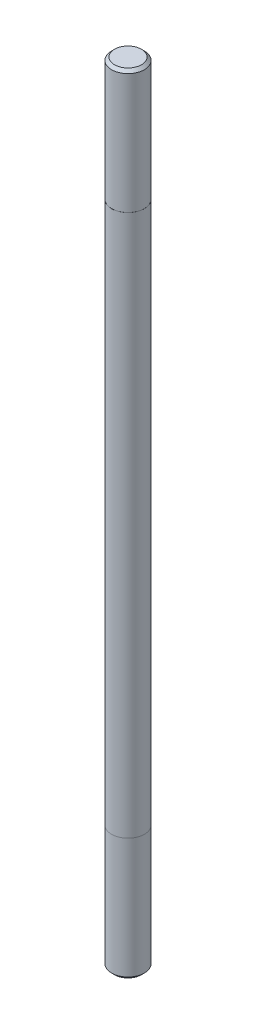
SolidWorks part; units mm, degrees
ref_plane "Front" through (0, 0, 0) normal (0, 0, 1) x (1, 0, 0)
ref_plane "Top" through (0, 0, 0) normal (0, 1, 0) x (1, 0, 0)
ref_plane "Right" through (0, 0, 0) normal (1, 0, 0) x (0, 0, -1)
sketch "Sketch1" plane through (0, 0, 0) normal (0, 1, 0) x (1, 0, 0)
  circle A0 centre (0, 0) radius 2
extrude "Extrude1" add sketch "Sketch1" along normal blind 66
sketch "Sketch2" plane through (0, 66, 0) normal (0, 1, 0) x (-1, 0, 0)
  circle A0 centre (0, 0) radius 1.99
extrude "Extrude2" add sketch "Sketch2" along normal blind 15
sketch "Sketch3" plane through (0, 0, 0) normal (0, -1, 0) x (1, 0, 0)
  circle A0 centre (0, 0) radius 1.99
extrude "Extrude3" add sketch "Sketch3" along normal blind 15
chamfer "Chamfer1" distance 0.35 angle 45 2 edges at (0, -15, -1.99) (0, 81, 1.99)
